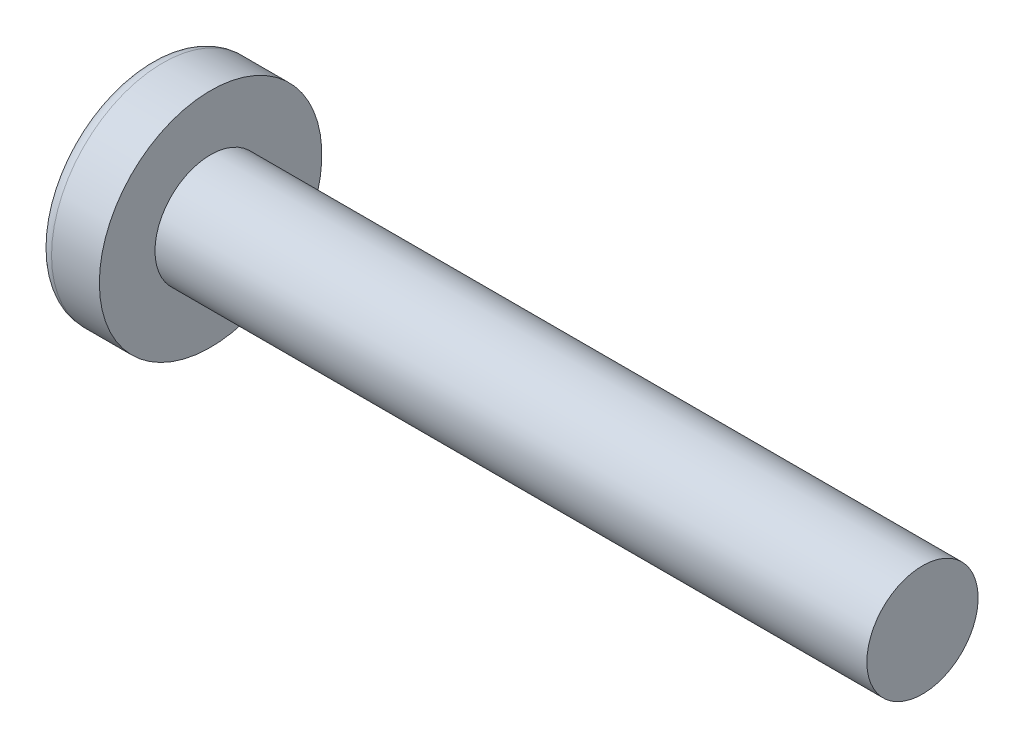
SolidWorks part; units mm, degrees
ref_plane "Plane1" through (0, 0, 0) normal (0, 0, 1) x (1, 0, 0)
ref_plane "Plane2" through (0, 0, 0) normal (0, 1, 0) x (1, 0, 0)
ref_plane "Plane3" through (0, 0, 0) normal (1, 0, 0) x (0, 0, -1)
sketch "BodySke" plane through (0, 0, 0) normal (0, 0, 1) x (1, 0, 0)
  line L0 (2.1, 1.25) -> (2.1, 2.5)
  line L1 (2.55, 6.35) -> (2.55, -3.175) construction
  line L2 (-25.4, 0) -> (127, 0) construction
  line L3 (18.1, 0) -> (0, 0)
  line L4 (2.1, 1.25) -> (18.1, 1.25)
  line L5 (18.1, 1.25) -> (18.1, 0)
  line L6 (1.0251, 2.5) -> (2.1, 2.5)
  line L7 (2.1, -1.25) -> (18.1, -1.25) construction
  line L8 (2.1, 6.35) -> (2.1, -3.175) construction
  arc A0 (0.7839, 2.3784) -> (0, 0) centre (4, 0) ccw
  arc A2 (0.7839, 2.3784) -> (1.0251, 2.5) centre (1.0251, 2.2) cw
  dimension "Head_fillet_rad" = 0.3
  dimension "Head_crown_rad" = 4
  dimension "Head_ht" = 2.1
  dimension "Diameter" = 2.5
  dimension "Length" = 16
  dimension "Head_dia" = 5
  dimension "Advance" = 0.45
  dimension "Thread_nom" = 16
revolve "Base-Revolve" add sketch "BodySke" angle 360 about L2
sketch "Sketch3" plane through (0, 0, 0) normal (1, 0, 0) x (0, 0, -1)
  line L0 (0.35, -1.34) -> (-0.35, -1.34)
  line L1 (0.35, -1.34) -> (0.35, 1.34)
  line L2 (-0.35, 1.34) -> (0.35, 1.34)
  line L3 (-0.35, 1.34) -> (-0.35, -1.34)
  dimension "D1" = 1.34
  dimension "Cross_dia" = 2.68
  dimension "D2" = 0.35
  dimension "Cross_width" = 0.7
ref_plane "Plane4" through (1.53, 0, 0) normal (1, 0, 0) x (0, 0, -1)
sketch "Sketch4" plane through (1.53, 0, 0) normal (1, 0, 0) x (0, 0, -1)
  line L0 (0.175, -0.175) -> (-0.175, -0.175)
  line L1 (0.175, -0.175) -> (0.175, 0.175)
  line L2 (-0.175, 0.175) -> (0.175, 0.175)
  line L3 (-0.175, 0.175) -> (-0.175, -0.175)
  dimension "D1" = 0.35
  dimension "D2" = 0.35
  dimension "D3" = 0.175
  dimension "D4" = 0.175
loft "Cut-Loft1" cut profiles "Sketch3", "Sketch4"
pattern_circular "CirPattern1" count 2 every 90 about axis through (0, 0, 0) along (1, 0, 0) of "Cut-Loft1"
sketch "ThdSchSke" plane through (0, 0, 0) normal (0, 0, 1) x (1, 0, 0)
  line L0 (2.55, -0.9965) -> (2.3725, -1.25)
  line L1 (2.55, -0.9965) -> (2.7275, -1.25)
  line L2 (2.7275, -1.25) -> (2.7275, -1.5625)
  line L3 (-3.175, 0) -> (5.1513, 0) construction
  line L5 (2.7275, -1.5625) -> (2.3725, -1.5625)
  line L6 (2.3725, -1.5625) -> (2.3725, -1.25)
  dimension "Thread_minor" = 1.993
  dimension "Diameter" = 2.5
  dimension "Start" = 2.55
  dimension "SideAngle" = 55
  dimension "VeeAngle" = 70
  dimension "Overcut" = 3.125
revolve "ThreadSchematic" [suppressed] cut sketch "ThdSchSke" angle 360 about L3
pattern_linear "ThdSchPat" [suppressed]
equation "\"D1@Sketch3\" = \"Cross_dia@Sketch3\" / 2"
equation "\"D2@Sketch3\" = \"Cross_width@Sketch3\" / 2"
equation "\"D1@Sketch4\" = \"Cross_width@Sketch3\" *.5"
equation "\"D2@Sketch4\" = \"D1@Sketch4\""
equation "\"D3@Sketch4\" = \"D1@Sketch4\" / 2"
equation "\"D4@Sketch4\" = \"D2@Sketch4\" / 2"
equation "\"Thread_length@ThreadCosmetic\" = ((sgn( (\"Length@BodySke\" - \"Advance@BodySke\" ) - \"Thread_nom@BodySke\" )-1)*( (\"Length@BodySke\" - \"Advance@BodySke\" ) - \"Thread_nom@BodySke\" ))/-2+ \"Thread_nom@BodySke\""
equation "\"Thread_minor@ThdSchSke\" = \"Thread_minor@ThreadCosmetic\""
equation "\"Diameter@ThdSchSke\" = \"Diameter@BodySke\""
equation "\"Overcut@ThdSchSke\" = \"Diameter@BodySke\" * 1.25"
equation "\"Start@ThdSchSke\" = \"Head_ht@BodySke\" + \"Length@BodySke\" - \"Thread_length@ThreadCosmetic\"  '---Non-countersunk---"
equation "\"Num_threads@ThdSchPat\" = int( \"Thread_length@ThreadCosmetic\" / \"Advance@BodySke\" + 0.999 )  + 1"
equation "\"Advance@ThdSchPat\" = \"Thread_length@ThreadCosmetic\" /  (\"Num_threads@ThdSchPat\" - 1) 'relax it"
